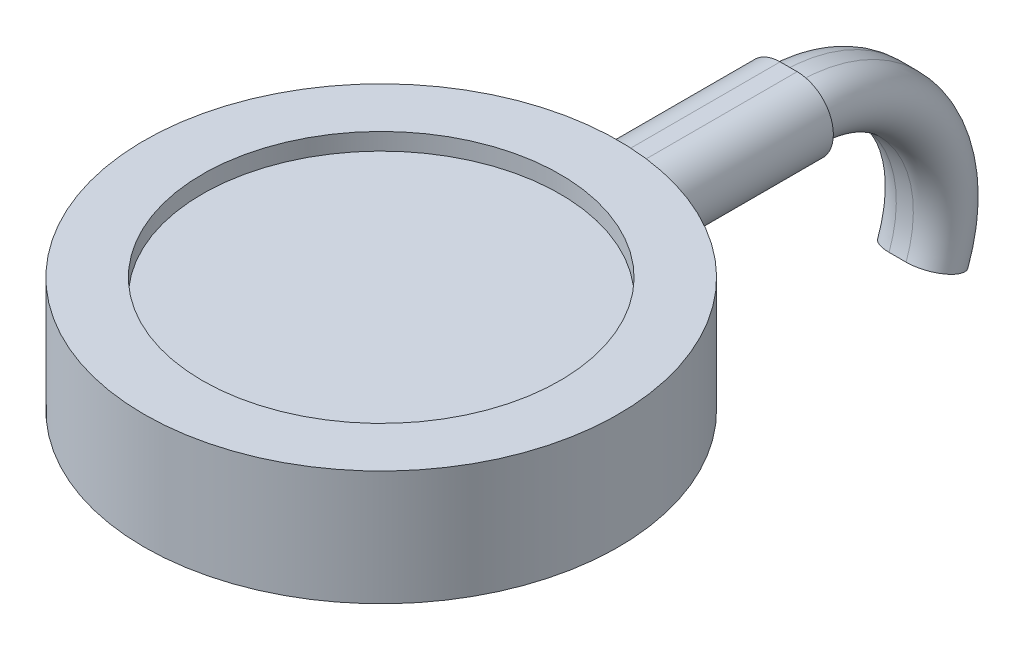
SolidWorks part; units mm, degrees
ref_plane "Front Plane" through (0, 0, 0) normal (0, 0, 1) x (1, 0, 0)
ref_plane "Top Plane" through (0, 0, 0) normal (0, 1, 0) x (1, 0, 0)
ref_plane "Right Plane" through (0, 0, 0) normal (1, 0, 0) x (0, 0, -1)
sketch "Sketch1" plane through (0, 0, 0) normal (0, 1, 0) x (1, 0, 0)
  circle A0 centre (0, 0) radius 13.925
  dimension "D1" = 27.85
extrude "Boss-Extrude1" add sketch "Sketch1" along normal mid plane 6.75 contours A0
sketch "Sketch2" plane through (0, 3.375, 0) normal (0, 1, 0) x (1, 0, 0)
  circle A0 centre (0, 0) radius 10.5
  dimension "D1" = 21
extrude "Cut-Extrude1" cut sketch "Sketch2" against normal blind 1
sketch "Sketch3" plane through (0, 0, 0) normal (0, 0, 1) x (1, 0, 0)
  line L0 (-0.5, 0) -> (0.5, 0) construction
  line L1 (-0.5, 2.125) -> (0.5, 2.125)
  line L2 (-0.5, -2.125) -> (0.5, -2.125)
  arc A0 (-0.5, 2.125) -> (-0.5, -2.125) centre (-0.5, 0) ccw
  arc A1 (0.5, -2.125) -> (0.5, 2.125) centre (0.5, 0) ccw
  point P3 (0, 0)
  dimension "D1" = 2.125
  dimension "D2" = 1
ref_plane "Plane1" through (0, 0, -13.925) normal (0, 0, -1) x (-1, 0, 0)
extrude "Boss-Extrude2" add sketch "Sketch3" against normal offset from surface (23.925 mm away) 10
sketch "Sketch7" plane through (0, -90.875, -61) normal (1, 0, 0) x (0, 0, -1)
  line L0 (-47.075, 90.875) -> (-37.075, 90.875) construction
  line L1 (-47.075, 87.1625) -> (-47.075, 94.5875) construction
  line L3 (-29.2004, 79.5666) -> (-44.1548, 30.1206) construction
  line L4 (-37.075, 90.875) -> (-37.075, 79.5666) construction
  line L5 (-37.075, 79.5666) -> (-29.2004, 79.5666) construction
  line L7 (-37.075, 88.75) -> (-37.075, 93) construction
  line L8 (-37.075, 88.75) -> (-37.075, 93) construction
  line L10 (-29.8751, 77.3358) -> (-43.2484, 33.1177) construction
  arc A0 (-37.075, 90.875) -> (-29.2004, 79.5666) centre (-37.075, 82.4791) cw
sketch "Sketch8" plane through (0, 0, -23.925) normal (0, 0, -1) x (-1, 0, 0)
  line L0 (-0.5, 0) -> (0.5, 0) construction
  line L1 (-0.5, 1.575) -> (0.5, 1.575)
  line L2 (-0.5, -1.575) -> (0.5, -1.575)
  arc A0 (-0.5, 1.575) -> (-0.5, -1.575) centre (-0.5, 0) ccw
  arc A1 (0.5, -1.575) -> (0.5, 1.575) centre (0.5, 0) ccw
  point P2 (0, 0)
  dimension "D1" = 1.575
  dimension "D2" = 1
sweep "Sweep1" add profiles "Sketch8" path "Sketch7"
ref_plane "Plane2" through (-1.55, -73.312, -57.2669) normal (-1, 0, 0) x (0, -0.2079, 0.9781)
sketch "Sketch9" plane through (-1.55, -73.312, -57.2669) normal (-1, 0, 0) x (0, -0.2079, 0.9781)
  line L0 (12.0195, 65.9435) -> (45.2206, 5.6193) construction
  line L1 (61.4804, -1.8203) -> (73.7841, 0.7949)
  line L2 (12.0195, 65.9435) -> (36.9275, 20.6873) construction
  line L4 (66.5457, 10.8) -> (66.9709, 8.8) construction
  line L5 (-12.7796, -20.6718) -> (94.9474, 2.2263) construction
  arc A0 (45.2206, 5.6193) -> (61.4804, -1.8203) centre (58.3617, 12.8519) ccw
  dimension "D2" = 15
  dimension "D1" = 3
  dimension "D3" = 5
ref_plane "Plane3" through (0, 0, 15.0701) normal (0, 0, 1) x (1, 0, 0)
